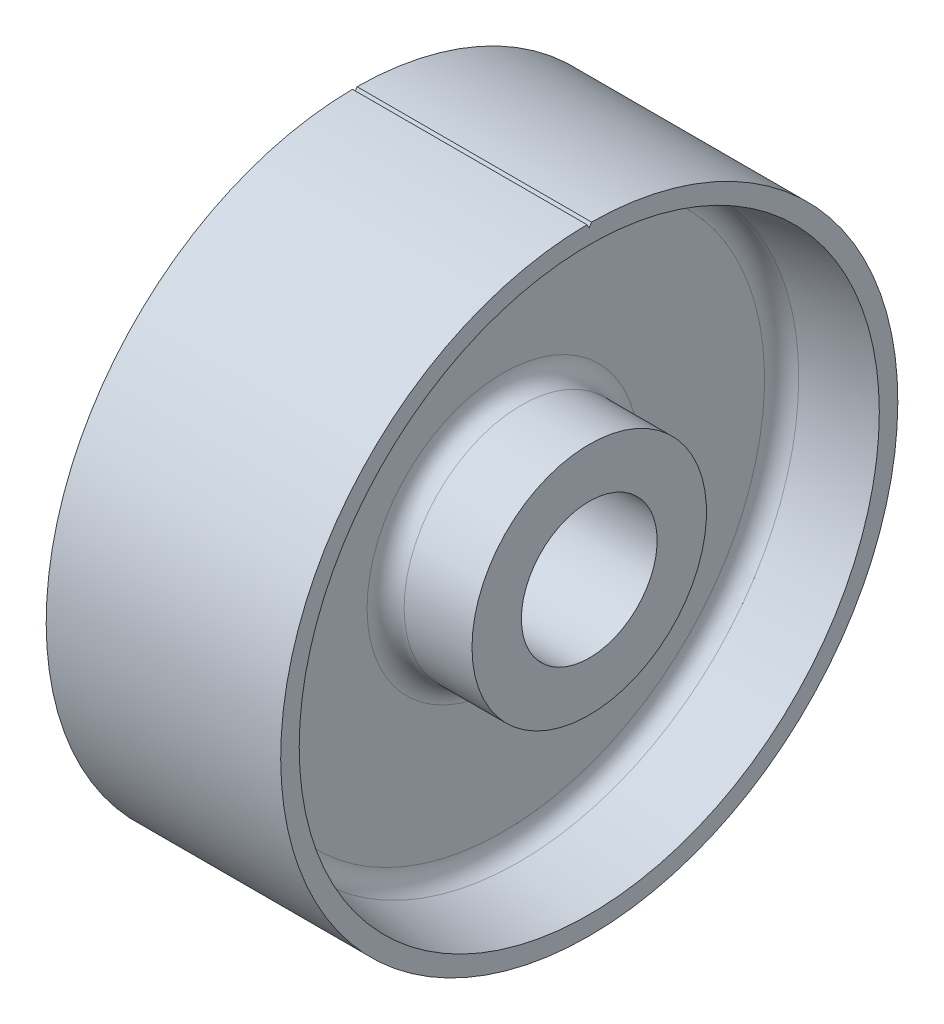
SolidWorks part; units mm, degrees
ref_plane "前基準面" through (0, 0, 0) normal (0, 0, 1) x (1, 0, 0)
ref_plane "上基準面" through (0, 0, 0) normal (0, 1, 0) x (1, 0, 0)
ref_plane "右基準面" through (0, 0, 0) normal (1, 0, 0) x (0, 0, -1)
sketch "草圖1" plane through (0, 0, 0) normal (0, 0, 1) x (1, 0, 0)
  line L0 (-30.6659, 0) -> (51.5106, 0) construction
  line L1 (0, 0) -> (0, 81.5752) construction
  line L2 (-19, 11) -> (19, 11)
  line L3 (19, 11) -> (19, 19)
  line L4 (-19, 11) -> (-19, 19)
  line L5 (19, 19) -> (5, 19)
  line L6 (-19, 19) -> (-5, 19)
  line L7 (5, 19) -> (5, 45)
  line L8 (-5, 19) -> (-5, 45)
  line L9 (5, 45) -> (19, 47)
  line L10 (-5, 45) -> (-19, 47)
  line L11 (19, 47) -> (19, 50)
  line L12 (-19, 47) -> (-19, 50)
  line L13 (19, 50) -> (-19, 50)
  point P8 (0, 11)
  point P19 (0, 50)
  dimension "D1" = 22
  dimension "D2" = 38
  dimension "D3" = 10
  dimension "D4" = 3
  dimension "D5" = 5
  dimension "D6" = 38
  dimension "D7" = 100
revolve "旋轉1" add sketch "草圖1" angle 360 about L0
fillet "圓角1" radius 3 4 edges at (-5, 0, 19) (5, 0, 19) (-5, 0, 45) (5, 0, 45)
sketch "草圖2" plane through (19, 0, 0) normal (1, 0, 0) x (0, 0, -1)
  line L0 (-0.9134, 50.9456) -> (0.9134, 50.9456)
  line L1 (0.9134, 50.9456) -> (0, 49.3635)
  line L2 (0, 49.3635) -> (-0.9134, 50.9456)
extrude "伸長1" cut sketch "草圖2" against normal through all
